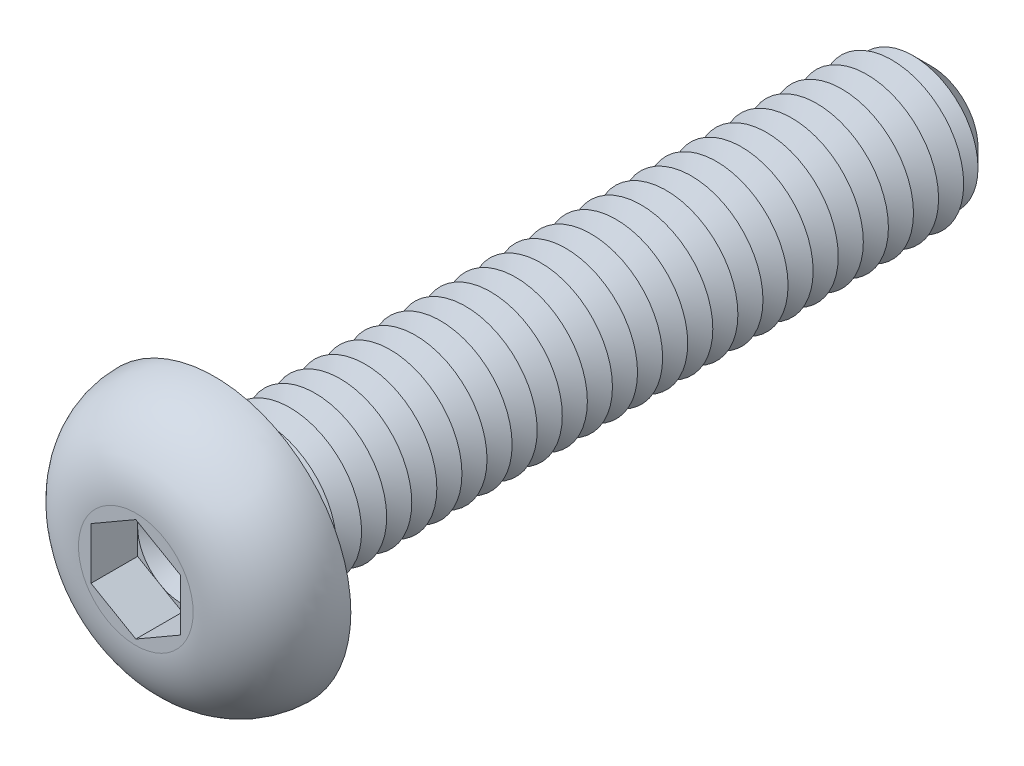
SolidWorks part; units mm, degrees
ref_plane "Front Plane" through (0, 0, 0) normal (0, 0, 1) x (1, 0, 0)
ref_plane "Top Plane" through (0, 0, 0) normal (0, 1, 0) x (1, 0, 0)
ref_plane "Right Plane" through (0, 0, 0) normal (1, 0, 0) x (0, 0, -1)
sketch "Sketch1" plane through (0, 0, 0) normal (1, 0, 0) x (0, 0, -1)
  line L0 (-47.9342, 0) -> (60.3146, 0) construction
sketch "Sketch2" plane through (0, 0, 0) normal (1, 0, 0) x (0, 0, -1)
  line L0 (0, 0) -> (-2.2, 0)
  line L1 (-47.9342, 0) -> (60.3146, 0) construction
  line L2 (-2.2, 0) -> (-2.2, 1.6)
  line L3 (0, 3.8) -> (0, 0)
  arc A0 (-2.2, 1.6) -> (0, 3.8) centre (0, 1.6) cw
  dimension "D1" = 2.2
  dimension "D2" = 2.2
  dimension "D3" = 3.8
revolve "Revolve1" add sketch "Sketch2" angle 360 about L0
sketch "Sketch3" plane through (0, 0, 2.2) normal (0, 0, 1) x (1, 0, 0)
  line L1 (0, 1.4434) -> (-1.25, 0.7217)
  line L2 (-1.25, 0.7217) -> (-1.25, -0.7217)
  line L3 (-1.25, -0.7217) -> (0, -1.4434)
  line L4 (0, -1.4434) -> (1.25, -0.7217)
  line L5 (1.25, -0.7217) -> (1.25, 0.7217)
  line L6 (1.25, 0.7217) -> (0, 1.4434)
  circle A0 centre (0, 0) radius 1.25 construction
  dimension "D1" = 2.5
extrude "Cut-Extrude1" cut sketch "Sketch3" against normal blind 1.3
sketch "Sketch4" plane through (0, 0, 0) normal (0, 0, -1) x (-1, 0, 0)
  circle A0 centre (0, 0) radius 2
  dimension "D1" = 4
extrude "Boss-Extrude1" add sketch "Sketch4" along normal blind 20
chamfer "Chamfer1" distance 0.7 angle 45 1 edges at (-2, 0, -20)
sketch "Sketch5" plane through (0, 0, 0) normal (1, 0, 0) x (0, 0, -1)
  line L0 (0.7, 2) -> (1.4, 2)
  line L1 (19.3, 2) -> (0, 2) construction
  line L2 (1.4, 2) -> (1.05, 1.3938)
  line L3 (1.05, 1.3938) -> (0.7, 2)
  line L4 (0, -3.8) -> (0, 3.8) construction
  line L5 (19.3, 2) -> (0, 2) construction
  dimension "D1" = 0.7
  dimension "D2" = 0.7
revolve "Cut-Revolve1" cut sketch "Sketch5" angle 360 about L0
pattern_linear "LPattern1" count 27 spacing 0.7 along (0, 0, -1) of "Cut-Revolve1"
fillet "Fillet2" radius 0.3 1 edges at (2, 0, 0)
sketch "Sketch6" plane through (0, 0, 0.9) normal (0, 0, 1) x (1, 0, 0)
  line L0 (0, -1.4434) -> (1.25, -0.7217) construction
  circle A0 centre (0, 0) radius 1.25
extrude "Cut-Extrude2" cut sketch "Sketch6" against normal through all draft 60
